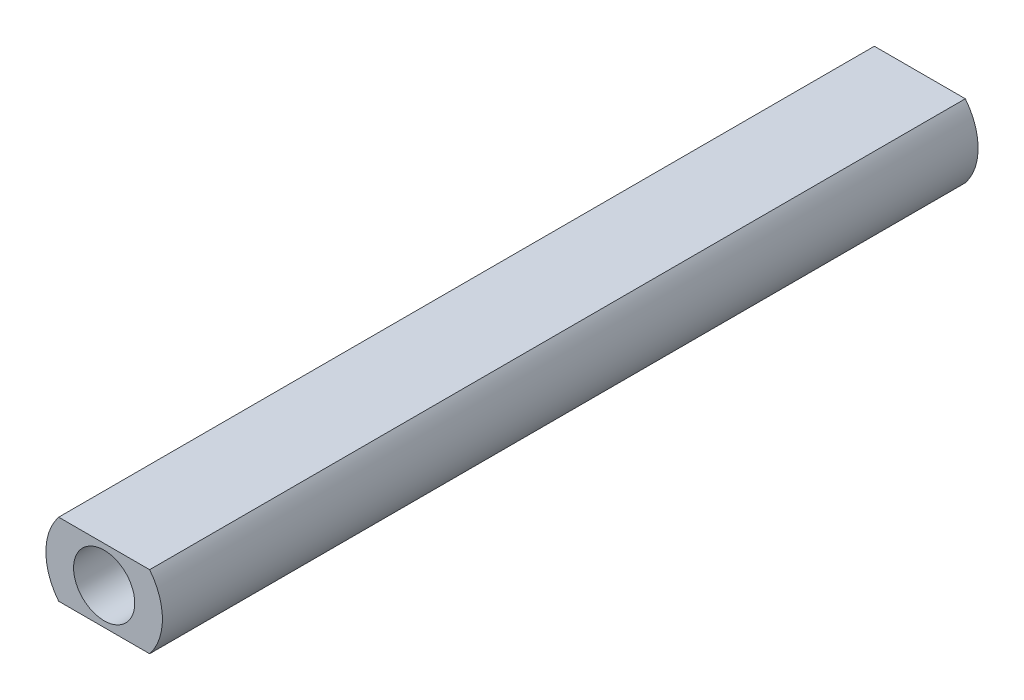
SolidWorks part; units mm, degrees
ref_plane "Face" through (0, 0, 0) normal (0, 0, 1) x (1, 0, 0)
ref_plane "Dessus" through (0, 0, 0) normal (0, 1, 0) x (1, 0, 0)
ref_plane "Droite" through (0, 0, 0) normal (1, 0, 0) x (0, 0, -1)
sketch "Esquisse1" plane through (0, 0, 0) normal (0, 0, 1) x (1, 0, 0)
  circle A0 centre (0, 0) radius 4
  dimension "D1" = 8
extrude "Extrusion1" add sketch "Esquisse1" along normal blind 28
hole_wizard "Trou taraudé M51" positions "Esquisse3" profile "Esquisse2" tap size "M5" standard "ISO"
sketch "Esquisse3" plane through (0, 0, 28) normal (0, 0, 1) x (1, 0, 0)
  point P0 (0, 0)
sketch "Esquisse2" plane through (0, 0, 28) normal (1, 0, 0) x (0, -1, 0)
  line L0 (0, 0) -> (0, 15.6618)
  line L1 (0, 15.6618) -> (2.1, 14.4)
  line L2 (2.1, 14.4) -> (2.1, 0)
  line L5 (2.1, 0) -> (0, 0)
  line L10 (0, 15.6618) -> (-2.1, 14.4) construction
  line L11 (0, -6.35) -> (0, 107.95) construction
  dimension "Diamètre du trou pour taraudage" = 4.2
  dimension "Profondeur du trou pour taraudage" = 14.4
  dimension "Angle de pointe" = 118
sketch "Esquisse4" plane through (0, 0, 0) normal (0, 0, 1) x (1, 0, 0)
  line L1 (-5.1661, 4.7731) -> (4.661, 4.7731)
  line L2 (-5.1661, 4.7731) -> (-5.1661, 2.5)
  line L3 (-5.1661, 2.5) -> (4.661, 2.5)
  line L4 (4.661, 4.7731) -> (4.661, 2.5)
  line L5 (-4.1897, -2.5) -> (5.3174, -2.5)
  line L6 (-4.1897, -2.5) -> (-4.1897, -5.5423)
  line L7 (-4.1897, -5.5423) -> (5.3174, -5.5423)
  line L8 (5.3174, -2.5) -> (5.3174, -5.5423)
  dimension "D1" = 2.5
  dimension "D2" = 2.5
extrude "Enlèv. mat.-Extru.1" cut sketch "Esquisse4" along normal through all
mirror "Symétrie1" about plane through (0, 0, 0) normal (0, 0, 1)
